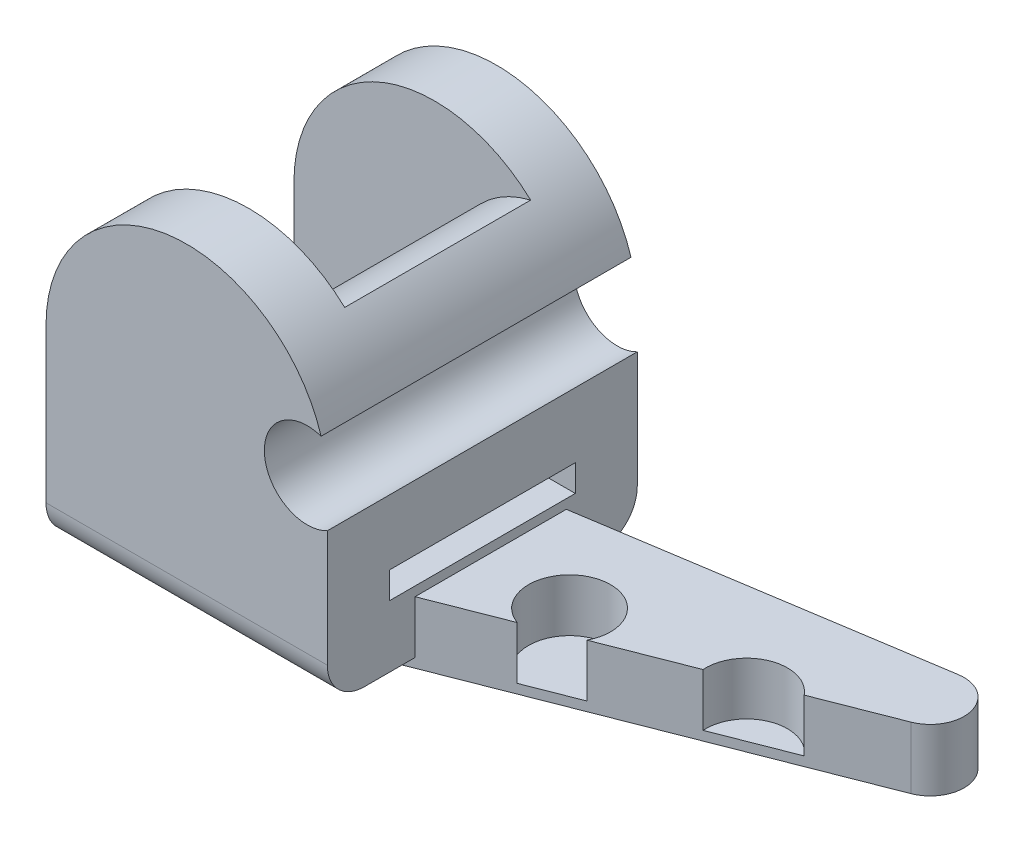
SolidWorks part; units mm, degrees
ref_plane "Front" through (0, 0, 0) normal (0, 0, 1) x (1, 0, 0)
ref_plane "Top" through (0, 0, 0) normal (0, 1, 0) x (1, 0, 0)
ref_plane "Right" through (0, 0, 0) normal (1, 0, 0) x (0, 0, -1)
sketch "Sketch4" plane through (0, 0, 0) normal (0, 0, 1) x (1, 0, 0)
  line L0 (-45.3888, 0) -> (-45.3888, -61.606)
  line L1 (-45.3888, -61.606) -> (45.3888, -61.606)
  line L2 (45.3888, -61.606) -> (45.3888, 0)
  arc A0 (45.3888, 0) -> (-45.3888, 0) centre (0, 0) ccw
extrude "\"U\" shape" add sketch "Sketch4" along normal blind 100
sketch "Sketch8" plane through (0, 0, 100) normal (0, 0, 1) x (1, 0, 0)
  circle A0 centre (38.9238, 0.2349) radius 13.8707
extrude "Inner Hole" cut sketch "Sketch8" against normal through all
shell "Thickness" thickness 20
fillet "Fillet" radius 12 2 edges at (0, -61.606, 100) (0, -61.606, 0)
ref_plane "Plane1" through (0, -64.606, 0) normal (0, -1, 0) x (1, 0, 0)
sketch "Sketch7" plane through (0, -64.606, 0) normal (0, -1, 0) x (1, 0, 0)
  line L0 (24.5188, 52.2089) -> (196.3713, 5.822) construction
  line L1 (24.5188, 26.1439) -> (154.8439, 5.822)
  line L2 (37.6343, 74.7337) -> (160.4842, 26.7179)
  line L3 (24.5188, 26.1439) -> (37.6343, 74.7337)
  arc A0 (154.8439, 5.822) -> (160.4842, 26.7179) centre (156.5212, 16.5784) ccw
extrude "Tongue" add sketch "Sketch7" against normal blind 20
sketch "Sketch9" plane through (0, -61.606, 0) normal (0, -1, 0) x (1, 0, 0)
  line L0 (-45.3888, 50) -> (169.8623, 50) construction
  line L1 (-45.3888, 80) -> (-45.3888, 20) construction
  circle A0 centre (73.5455, 50) radius 13.2198
  circle A2 centre (125.389, 44.7268) radius 13.2198
extrude "Mounting Holes" cut sketch "Sketch9" against normal through all
